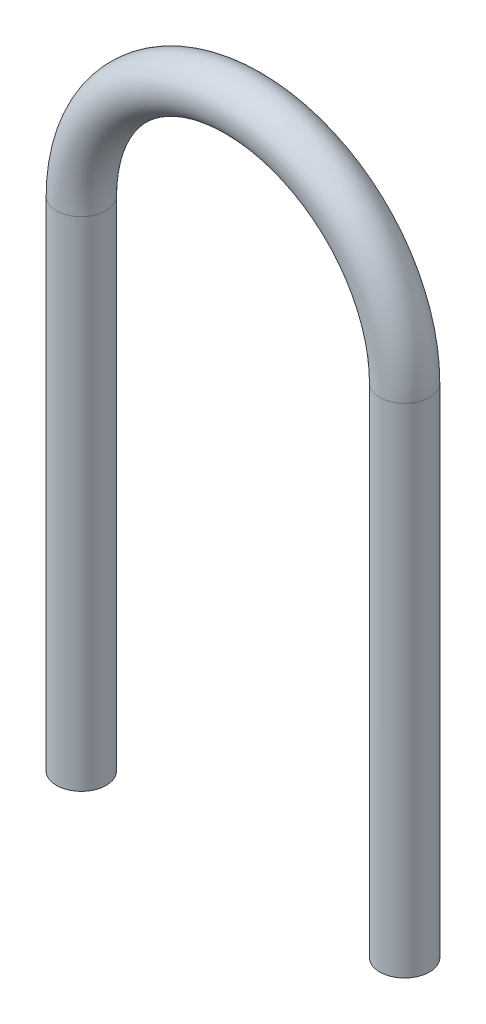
SolidWorks part; units mm, degrees
ref_plane "Front Plane" through (0, 0, 0) normal (0, 0, 1) x (1, 0, 0)
ref_plane "Top Plane" through (0, 0, 0) normal (0, 1, 0) x (1, 0, 0)
ref_plane "Right Plane" through (0, 0, 0) normal (1, 0, 0) x (0, 0, -1)
sketch "Sketch1" plane through (0, 0, 0) normal (0, 1, 0) x (1, 0, 0)
  circle A0 centre (0, 0) radius 1.5875
  dimension "D1" = 3.175
sketch "Sketch2" plane through (0, 0, 0) normal (0, 0, 1) x (1, 0, 0)
  line L0 (0, 0) -> (0, 31.75)
  line L1 (1.5875, 0) -> (-1.5875, 0) construction
  line L2 (20.6248, 31.75) -> (20.6248, 0)
  arc A0 (0, 31.75) -> (20.6248, 31.75) centre (10.3124, 31.75) cw
  dimension "D1" = 20.6248
  dimension "D2" = 31.75
sweep "Sweep1" add profiles "Sketch1" path "Sketch2"
